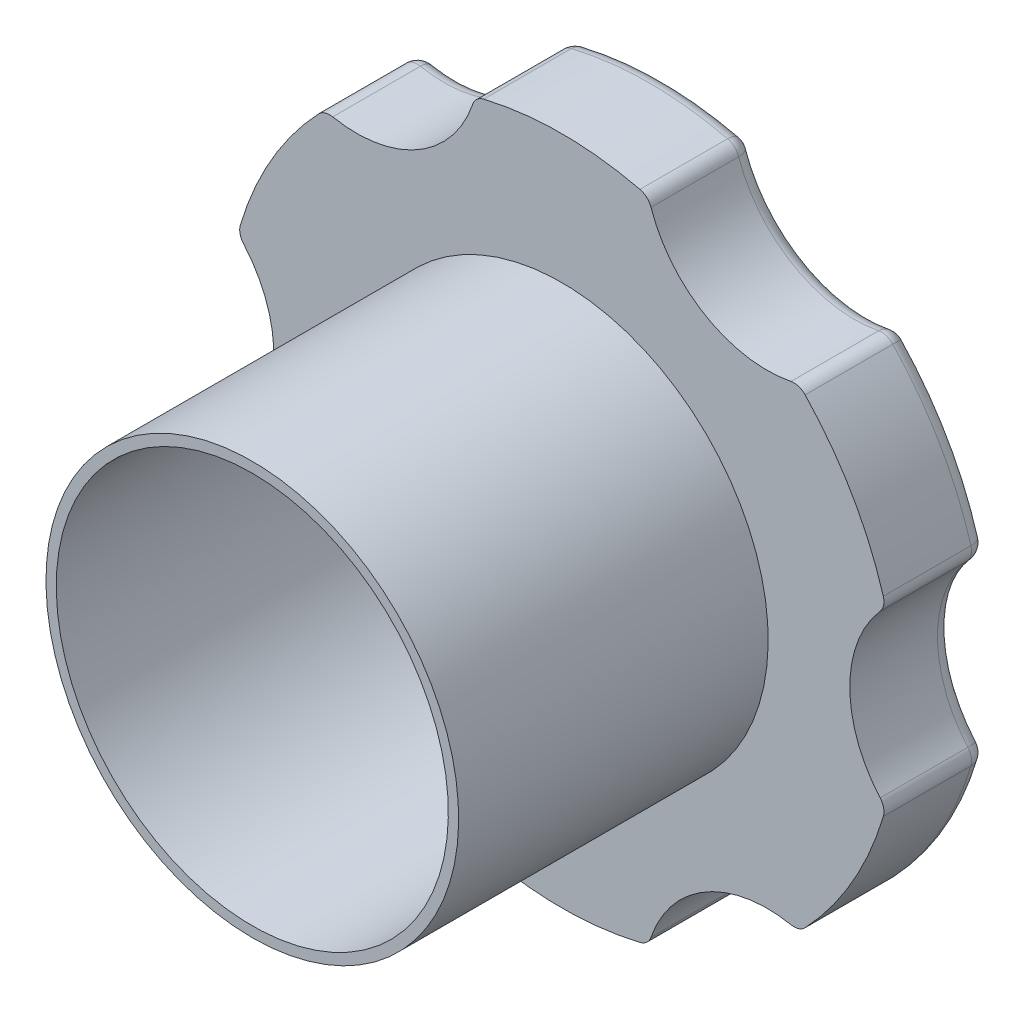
SolidWorks part; units mm, degrees
ref_plane "Front Plane" through (0, 0, 0) normal (0, 0, 1) x (1, 0, 0)
ref_plane "Top Plane" through (0, 0, 0) normal (0, 1, 0) x (1, 0, 0)
ref_plane "Right Plane" through (0, 0, 0) normal (1, 0, 0) x (0, 0, -1)
sketch "Sketch1" plane through (0, 0, 0) normal (1, 0, 0) x (0, 0, -1)
  line L0 (-20, 0) -> (20, 0)
  line L1 (18.5, 32.5) -> (10, 32.5)
  line L2 (20, 31) -> (20, 0)
  line L3 (10, 32.5) -> (10, 20)
  line L6 (10, 20) -> (-20, 20)
  line L7 (-20, 20) -> (-20, 0)
  arc A0 (20, 31) -> (18.5, 32.5) centre (18.5, 31) ccw
  point P4 (0, 0)
  point P13 (20, 32.5)
  dimension "D6" = 1.5
  dimension "D1" = 40
  dimension "D2" = 32.5
  dimension "D3" = 10
  dimension "D4" = 20
revolve "Revolve1" add sketch "Sketch1" angle 360 about L0
sketch "Sketch2" plane through (0, 0, -20) normal (0, 0, -1) x (-1, 0, 0)
  line L0 (0, 0) -> (22.981, 22.981) construction
  line L1 (0, 0) -> (-8.4116, 31.3926) construction
  line L2 (0, 0) -> (8.4116, 31.3926) construction
  line L3 (0, 0) -> (31.3926, 8.4116) construction
  line L4 (0, 0) -> (31.3926, -8.4116) construction
  line L5 (0, 0) -> (22.981, -22.981) construction
  line L6 (0, 0) -> (8.4116, -31.3926) construction
  line L7 (0, 0) -> (-8.4116, -31.3926) construction
  line L8 (0, 0) -> (-22.981, -22.981) construction
  line L9 (0, 0) -> (-31.3926, -8.4116) construction
  line L10 (0, 0) -> (-31.3926, 8.4116) construction
  line L11 (0, 0) -> (-22.981, 22.981) construction
  arc A0 (-31.3926, 8.4116) -> (-31.3926, -8.4116) centre (0, 0) ccw
  arc A1 (-22.981, 22.981) -> (-8.4116, 31.3926) centre (-19.9021, 34.4715) ccw
  arc A2 (8.4116, 31.3926) -> (22.981, 22.981) centre (19.9021, 34.4715) ccw
  arc A3 (-22.981, -22.981) -> (-8.4116, -31.3926) centre (-19.9021, -34.4715) cw
  arc A4 (8.4116, -31.3926) -> (22.981, -22.981) centre (19.9021, -34.4715) cw
  arc A5 (-31.3926, 8.4116) -> (-31.3926, -8.4116) centre (-39.8042, 0) cw
  arc A6 (31.3926, 8.4116) -> (31.3926, -8.4116) centre (39.8042, 0) ccw
  arc A7 (-22.981, -22.981) -> (-8.4116, -31.3926) centre (0, 0) ccw
  arc A8 (8.4116, -31.3926) -> (22.981, -22.981) centre (0, 0) ccw
  arc A9 (31.3926, -8.4116) -> (31.3926, 8.4116) centre (0, 0) ccw
  arc A10 (22.981, 22.981) -> (8.4116, 31.3926) centre (0, 0) ccw
  arc A11 (-8.4116, 31.3926) -> (-22.981, 22.981) centre (0, 0) ccw
  point P18 (0, 0)
  dimension "D1" = 65
  dimension "D2" = 6
extrude "Cut-Extrude1" cut sketch "Sketch2" against normal blind 10 contours A1 A11
fillet "Fillet1" radius 1.5 30 edges at (8.4918, 31.1075, -19.3356) (22.4942, 22.8615, -19.5488) (13.9542, 24.1694, -20) (31.3926, 8.4116, -14.25) (31.3926, -8.4116, -14.25) (31.0457, -8.0498, -19.5488) (31.1858, 8.1996, -19.3356) (27.9084, 0, -20) (22.981, -22.981, -14.25) (8.4116, -31.3926, -14.25) (8.5515, -30.9113, -19.5488) (22.694, -22.9079, -19.3356) (13.9542, -24.1694, -20) (-8.4116, -31.3926, -14.25) (-22.981, -22.981, -14.25) (-22.4942, -22.8615, -19.5488) (-8.4918, -31.1075, -19.3356) (-13.9542, -24.1694, -20) (-31.3926, -8.4116, -14.25) (-31.3926, 8.4116, -14.25) (-31.1858, -8.1996, -19.3356) (-31.0457, 8.0498, -19.5488) (-27.9084, 0, -20) (-22.981, 22.981, -14.25) (-8.4116, 31.3926, -14.25) (-22.694, 22.9079, -19.3356) (-8.5515, 30.9113, -19.5488) (-13.9542, 24.1694, -20) (8.4116, 31.3926, -14.25) (22.981, 22.981, -14.25)
shell "Shell1" thickness 1
